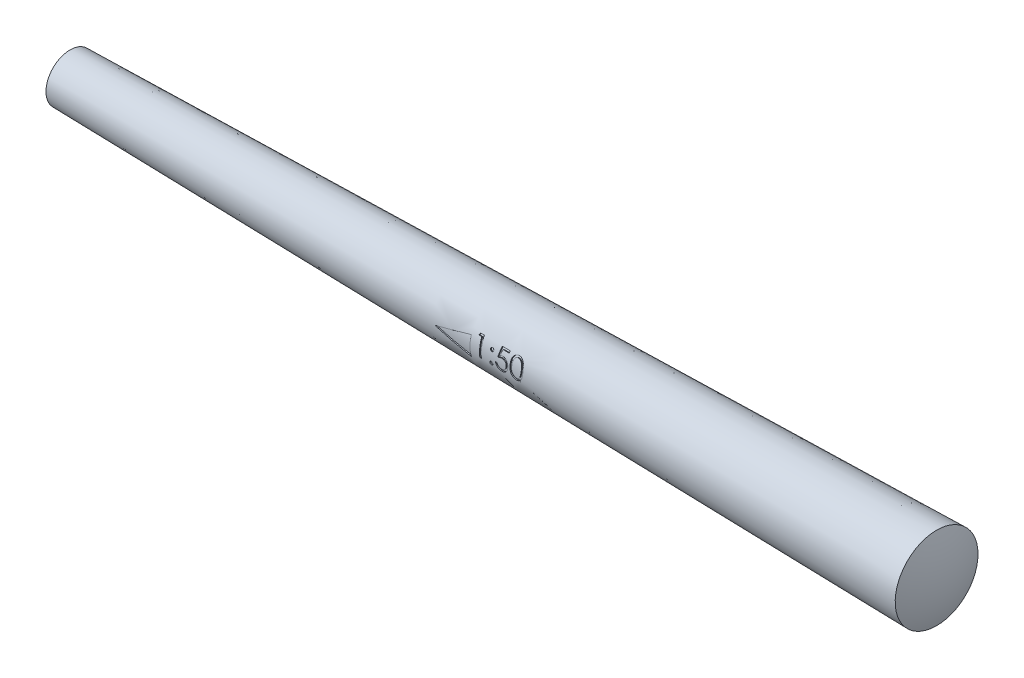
SolidWorks part; units mm, degrees
ref_plane "Front Plane" through (0, 0, 0) normal (0, 0, 1) x (1, 0, 0)
ref_plane "Top Plane" through (0, 0, 0) normal (0, 1, 0) x (1, 0, 0)
ref_plane "Right Plane" through (0, 0, 0) normal (1, 0, 0) x (0, 0, -1)
sketch "Sketch1" plane through (0, 0, 0) normal (1, 0, 0) x (0, 0, -1)
  circle A0 centre (0, 0) radius 1.25
  dimension "D1" = 2.5
extrude "Extrude1" add sketch "Sketch1" along normal mid plane 45
draft "Draft1" type of draft neutral plane draft angle 1.146 faces to draft 1 parameters "D1"=1.146
sketch "Sketch2" plane through (0, 0, 0) normal (0, 0, 1) x (1, 0, 0)
  line L0 (-22.5, 0) -> (-22.5, 1.25)
  line L1 (-22.5, 1.25) -> (-22.5, -1.25) construction
  line L2 (-22.5, 0) -> (-22.9, 0)
  line L3 (-22.9, 0) -> (-22.9, -1.7) construction
  line L4 (22.5, 0) -> (22.5, 2.15)
  line L5 (22.5, -2.15) -> (22.5, 2.15) construction
  line L6 (22.5, 0) -> (22.9, 0)
  line L7 (22.9, 0) -> (22.9, -1.7) construction
  line L8 (-22.5, -1.25) -> (22.5, -2.15) construction
  arc A0 (-22.9, 0) -> (-22.5, 1.25) centre (-20.7469, 0) cw
  arc A1 (22.9, 0) -> (22.5, 2.15) centre (16.9217, 0) ccw
  point P14 (0, -1.7)
revolve "Revolve1" add sketch "Sketch2" angle 360 about L2
sketch "Sketch5" plane through (0, 0, 0) normal (0, 0, 1) x (1, 0, 0)
  line L0 (0, 1.7) -> (0, -1.7) construction
  line L1 (22.5, 2.15) -> (-22.5, 1.25) construction
  line L2 (-22.5, -1.25) -> (22.5, -2.15) construction
ref_plane "Plane2" through (0, 0, 0) normal (-0.02, 0, 0.9998) x (0.9998, 0, 0.02)
sketch "Sketch6" plane through (0, 0, 0) normal (-0.02, 0, 0.9998) x (0.9998, 0, 0.02)
  line L0 (0, 0) -> (0, 0.5)
  line L1 (0, 1.7) -> (0, -1.7) construction
  line L2 (0, 0.5) -> (-1.866, 0)
  line L3 (-1.866, 0) -> (0, -0.5)
  line L4 (0, -0.5) -> (0, 0)
  line L5 (0, -0.25) -> (3, -0.25) construction
  text T0 "1:50" font "Century Gothic" height 1
  dimension "D1" = 1
  dimension "D2" = 30
  dimension "D3" = 3
wrap "Wrap2" sketch "Sketch6" wrap type deboss source sketch "Sketch6" thickness 0.05 parameters "D1"=0.05
equation "\"D2@Sketch2\" = \"D1@Sketch2\""
